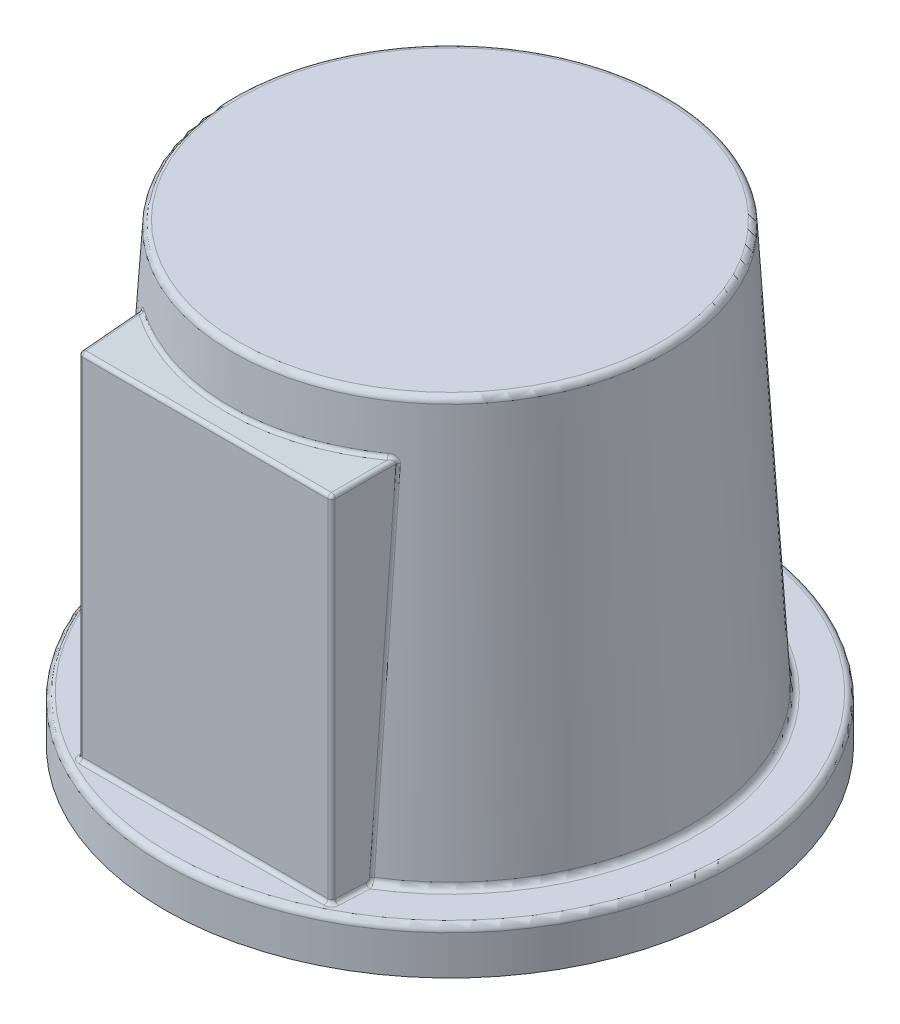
SolidWorks part; units mm, degrees
ref_plane "Face" through (0, 0, 0) normal (0, 0, 1) x (1, 0, 0)
ref_plane "Dessus" through (0, 0, 0) normal (0, 1, 0) x (1, 0, 0)
ref_plane "Droite" through (0, 0, 0) normal (1, 0, 0) x (0, 0, -1)
inserted part "Socle"
other "<Socle>-<Enlèv. mat.-Extru.4>"
sketch "Esquisse1" plane through (0, -13.9561, 0) normal (0, 1, 0) x (-1, 0, 0)
  circle A0 centre (-20.9732, 10.6432) radius 113
extrude "Extrusion1" add sketch "Esquisse1" against normal blind 18
sketch "Esquisse2" plane through (0, -13.9561, 0) normal (0, 1, 0) x (-1, 0, 0)
  circle A0 centre (-20.9732, 10.6432) radius 95.4723
extrude "Extrusion2" add sketch "Esquisse2" along normal blind 162 draft 3.37
sketch "Esquisse3" plane through (0, -31.9561, 0) normal (0, -1, 0) x (1, 0, 0)
  circle A0 centre (20.9732, 10.6432) radius 73
extrude "Enlèv. mat.-Extru.1" cut sketch "Esquisse3" against normal blind 156
ref_plane "Plan1" through (0, 0, 107) normal (0, 0, 1) x (1, 0, 0)
sketch "Esquisse8" plane through (0, 0, 107) normal (0, 0, 1) x (1, 0, 0)
  line L0 (133.9732, -13.9561) -> (-92.0268, -13.9561) construction
  line L1 (-29.5959, -13.9561) -> (70.4041, -13.9561)
  line L2 (-29.5959, -13.9561) -> (-29.5959, 126.0439)
  line L3 (-29.5959, 126.0439) -> (70.4041, 126.0439)
  line L4 (70.4041, -13.9561) -> (70.4041, 126.0439)
  dimension "D1" = 140
  dimension "D2" = 100
extrude "Extrusion8" add sketch "Esquisse8" against normal up to next draft 2.5
fillet "Congé1" radius 2.5 5 edges at (20.9732, 124.0439, -62.3568) (20.9732, -31.9561, -62.3568) (20.9732, -13.9561, 123.6432) (21.6636, -13.9561, -84.8266) (20.9732, 148.0439, 96.5761)
fillet "Congé21" radius 1.5 10 edges at (71.0372, -13.1076, 92.4997) (-30.2677, -12.9448, 91.6125) (70.6715, -13.9561, 100.8752) (-29.8787, -13.9561, 100.5224) (20.4041, 126.0439, 107) (70.4041, 56.0439, 107) (20.4041, -13.9561, 107) (-29.5959, 56.0439, 107)
fillet "Congé22" radius 1.5 7 edges at (71.5857, 127.14, 81.896) (70.0054, 125.6452, 106.5835) (-30.9611, 127.19, 80.7498) (-29.1972, 125.6452, 106.5835) (70.9726, 126.6124, 93.9797) (20.2543, 126.4436, 97.8451) (-30.1833, 126.6314, 93.545)
